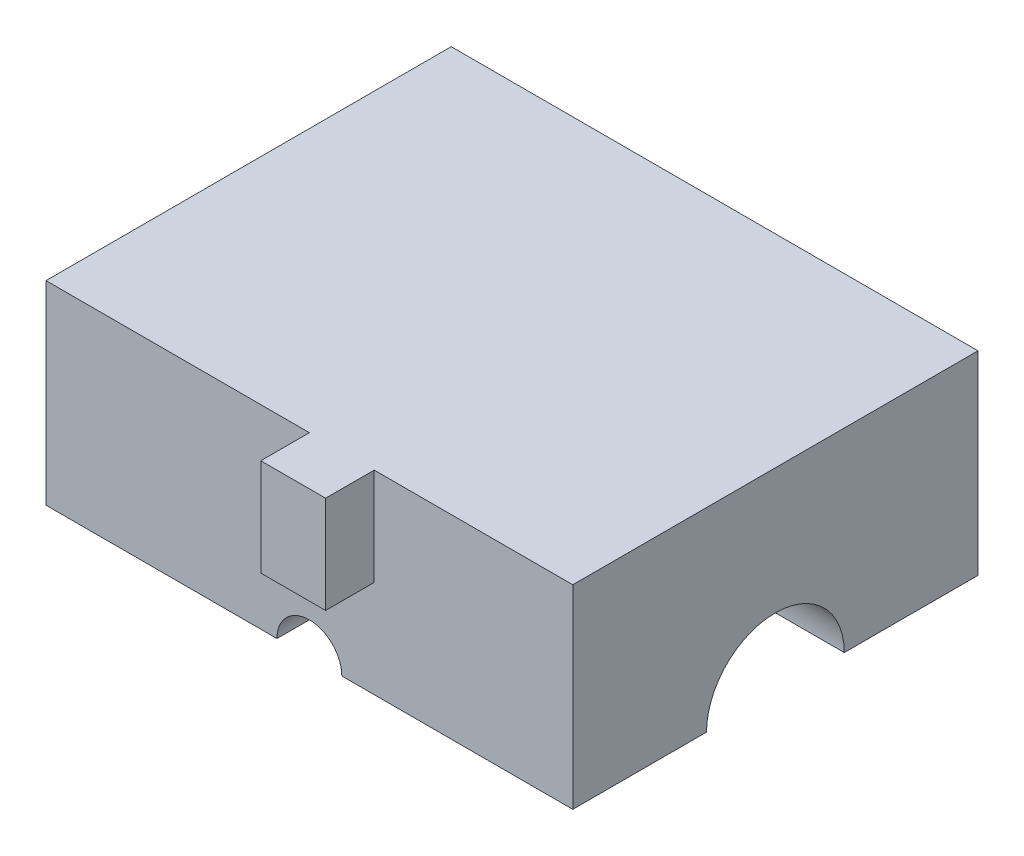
SolidWorks part; units mm, degrees
ref_plane "Front Plane" through (0, 0, 0) normal (0, 0, 1) x (1, 0, 0)
ref_plane "Top Plane" through (0, 0, 0) normal (0, 1, 0) x (1, 0, 0)
ref_plane "Right Plane" through (0, 0, 0) normal (1, 0, 0) x (0, 0, -1)
sketch "Sketch1" plane through (0, 0, 0) normal (0, 1, 0) x (1, 0, 0)
  line L0 (-206.375, 158.75) -> (206.375, -158.75) construction
  line L1 (-206.375, 158.75) -> (206.375, 158.75)
  line L2 (-206.375, 158.75) -> (-206.375, -158.75)
  line L3 (-206.375, -158.75) -> (206.375, -158.75)
  line L4 (206.375, 158.75) -> (206.375, -158.75)
  dimension "D1" = 317.5
  dimension "D2" = 412.75
extrude "Extrude1" add sketch "Sketch1" along normal blind 152.4
sketch "Sketch6" plane through (0, 0, 0) normal (0, 1, 0) x (1, 0, 0)
  line L0 (0, -158.75) -> (25.4, -158.75)
  line L1 (-206.375, -158.75) -> (206.375, -158.75) construction
  line L2 (25.4, -158.75) -> (25.4, -95.25)
  line L3 (25.4, -95.25) -> (76.2, -95.25)
  line L4 (76.2, -95.25) -> (76.2, 95.25)
  line L5 (76.2, 95.25) -> (25.4, 95.25)
  line L6 (25.4, 95.25) -> (25.4, 158.75)
  line L7 (206.375, 158.75) -> (-206.375, 158.75) construction
  line L8 (25.4, 158.75) -> (0, 158.75)
  line L9 (0, 158.75) -> (0, -158.75)
  line L10 (0, -190.3347) -> (0, 192.637) construction
  dimension "D1" = 76.2
  dimension "D2" = 63.5
  dimension "D3" = 25.4
revolve "Cut-Revolve3" cut sketch "Sketch6" angle 360 about L10
sketch "Sketch7" plane through (0, 0, 0) normal (1, 0, 0) x (0, 0, -1)
  circle A0 centre (0, 0) radius 53.975
  dimension "D1" = 107.95
extrude "Extrude3" cut sketch "Sketch7" against normal through all and the other way through all
fillet "Fillet2" radius 25.4 2 edges at (53.9569, 53.806, -4.2675) (-53.9569, 53.806, 4.2675)
sketch "Sketch8" plane through (0, 0, 158.75) normal (0, 0, 1) x (1, 0, 0)
  line L0 (-206.375, 152.4) -> (206.375, 152.4) construction
  line L1 (0, 152.4) -> (50.8, 152.4)
  line L2 (0, 152.4) -> (0, 76.2)
  line L3 (0, 76.2) -> (50.8, 76.2)
  line L4 (50.8, 152.4) -> (50.8, 76.2)
  dimension "D1" = 50.8
  dimension "D2" = 76.2
extrude "Boss-Extrude1" add sketch "Sketch8" along normal blind 38.1
